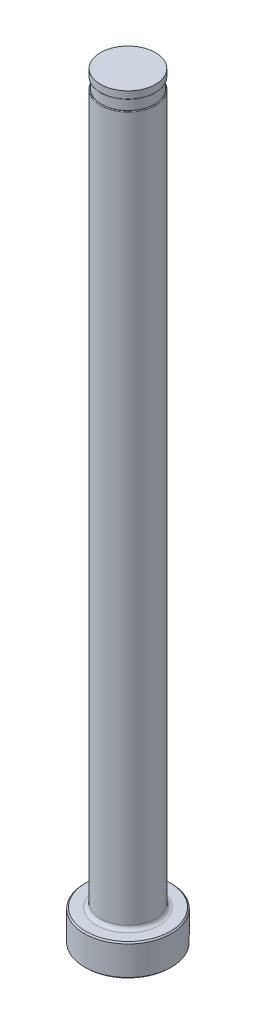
SolidWorks part; units mm, degrees
ref_plane "Front Plane" through (0, 0, 0) normal (0, 0, 1) x (1, 0, 0)
ref_plane "Top Plane" through (0, 0, 0) normal (0, 1, 0) x (1, 0, 0)
ref_plane "Right Plane" through (0, 0, 0) normal (1, 0, 0) x (0, 0, -1)
other "Configuration Table"
sketch "Sketch1" plane through (0, 0, 0) normal (0, 0, 1) x (1, 0, 0)
  line L0 (0, 259.9588) -> (0, -15.1925) construction
  line L1 (0, 0) -> (-8.7249, 0)
  line L2 (-8.7249, 0) -> (-8.7249, 6.35)
  line L3 (-8.7249, 6.35) -> (-5.5562, 6.35)
  line L4 (-5.5562, 6.35) -> (-5.5562, 152.4)
  line L5 (-5.5562, 152.4) -> (0, 152.4)
  line L6 (0, 152.4) -> (0, 0)
  dimension "L" = 152.4
  dimension "H" = 17.4498
  dimension "T" = 6.35
  dimension "D" = 11.1125
revolve "Revolve1" add sketch "Sketch1" angle 360 about L0
chamfer "Chamfer1" distance 0.254 angle 45 2 edges at (0, 6.35, 8.7249) (0, 0, 8.7249)
fillet "Fillet1" radius 0.762 1 edges at (0, 6.35, 5.5562)
sketch "Sketch2" plane through (0, 0, 0) normal (0, 0, 1) x (1, 0, 0)
  line L0 (-5.5562, 152.4) -> (-5.5562, 7.112) construction
  line L1 (-5.5562, 150.876) -> (-5.353, 150.876)
  line L2 (-5.5562, 150.876) -> (-5.5562, 148.844)
  line L3 (-5.5562, 148.844) -> (-5.353, 148.844)
  line L4 (-5.353, 150.876) -> (-5.353, 148.844)
  line L5 (5.5562, 152.4) -> (-5.5562, 152.4) construction
  line L6 (0, 153.4483) -> (0, 147.3282) construction
  dimension "D1" = 2.032
  dimension "N" = 1.524
  dimension "FD" = 0.2032
  dimension "D3" = 10.7061
revolve "Vent Relief" cut sketch "Sketch2" angle 360 about L6
sketch "Sketch3" plane through (0, 0, 0) normal (0, 0, 1) x (1, 0, 0)
  line L0 (-5.353, 149.86) -> (-5.353, 86.36)
  line L1 (-5.353, 150.876) -> (-5.353, 148.844) construction
  line L2 (-5.5562, 148.844) -> (-5.5562, 7.112) construction
  line L3 (-5.5562, 85.2424) -> (-5.5562, 149.86)
  line L4 (-5.5562, 149.86) -> (-5.353, 149.86)
  arc A0 (-5.353, 86.36) -> (-5.5562, 85.2424) centre (-8.528, 86.36) cw
  dimension "D1" = 3.175
  dimension "D2" = 63.5
extrude "D-Slot" cut sketch "Sketch3" against normal through all both and the other way through all
sketch "Sketch5" plane through (0, 0, 0) normal (0, 0, 1) x (1, 0, 0)
  line L0 (-5.5562, 150.876) -> (5.5562, 150.876) construction
  line L1 (-5.5562, 152.4) -> (-5.5308, 152.4)
  line L2 (-5.5562, 152.4) -> (-5.5562, 150.876)
  line L3 (-5.5562, 150.876) -> (-5.5308, 150.876)
  line L4 (-5.5308, 152.4) -> (-5.5308, 150.876)
  line L5 (0, 152.6877) -> (0, 150.5771) construction
  dimension "VP" = 0.0254
revolve "Vent Diameter" cut sketch "Sketch5" angle 360 about L5
fillet "Fillet2" radius 0.127 2 edges at (5.5562, 148.844, 0) (0, 150.876, 5.5308)
sketch "Pocket Sketch" plane through (0, 0, 0) normal (0, 0, 1) x (1, 0, 0)
  line L0 (-9.1218, 0) -> (-9.1218, 6.3754)
  line L1 (-9.1218, 6.3754) -> (-6.5167, 6.3754)
  line L2 (-5.7547, 7.1374) -> (-5.7547, 22.225)
  line L3 (-5.7547, 22.225) -> (0, 22.225)
  line L4 (0, 22.225) -> (0, 0)
  line L5 (0, 0) -> (-9.1218, 0)
  line L6 (0, 12.6104) -> (0, -2.4989) construction
  line L7 (-8.7249, 6.096) -> (-8.7249, 0.254) construction
  line L8 (8.4709, 6.35) -> (-8.4709, 6.35) construction
  line L9 (-5.5562, 85.2424) -> (-5.5562, 7.112) construction
  line L10 (-6.5167, 6.3754) -> (-5.7547, 7.1374)
  point P3 (-5.7547, 6.3754)
  dimension "D1" = 18.2435
  dimension "D2" = 0.3969
  dimension "D3" = 0.0254
  dimension "D4" = 0.1984
  dimension "D5" = 11.5094
  dimension "D6" = 22.225
